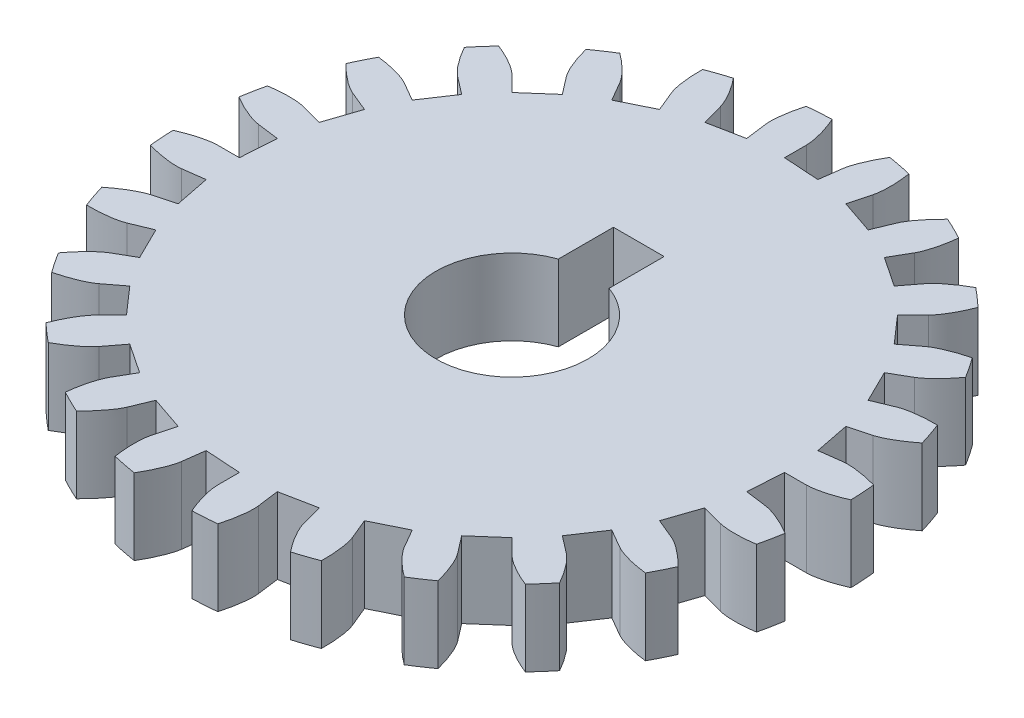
SolidWorks part; units mm, degrees
ref_plane "Front Plane" through (0, 0, 0) normal (0, 0, 1) x (1, 0, 0)
ref_plane "Top Plane" through (0, 0, 0) normal (0, 1, 0) x (1, 0, 0)
ref_plane "Right Plane" through (0, 0, 0) normal (1, 0, 0) x (0, 0, -1)
sketch "Sketch1" plane through (0, 0, 0) normal (0, 1, 0) x (1, 0, 0)
  line L0 (0, 0) -> (0, 5.8089) construction
  line L1 (0, 0) -> (-5.8089, 0) construction
  line L2 (0, 0) -> (-6.4861, -0.4251) construction
  line L3 (0, 0) -> (-5.7592, -0.7582) construction
  line L4 (0, 0) -> (-5.611, -1.5035) construction
  circle A0 centre (0, 0) radius 6 construction
  circle A1 centre (0, 0) radius 5.8089 construction
  circle A2 centre (0, 0) radius 5.375 construction
  circle A3 centre (0, 0) radius 6.5 construction
  spline S0 degree 4 poles (-5.8089, 0) (-5.8221, 0) (-5.8593, -0.0014) (-5.9292, -0.0093) (-6.0422, -0.0299) (-6.1841, -0.0671) (-6.3641, -0.1276) (-6.5708, -0.2146) (-6.7913, -0.3262) (-7.0229, -0.4642) (-7.2457, -0.6163) (-7.4597, -0.7807) (-7.6648, -0.9559) (-7.9031, -1.1803) (-8.1741, -1.4675) (-8.4679, -1.8248) (-8.7724, -2.2584) (-9.05, -2.7214) (-9.2956, -3.2019) (-9.5101, -3.6973) (-9.6942, -4.2043) (-9.8294, -4.6572) (-9.9272, -5.049) (-9.997, -5.3801) (-10.0457, -5.6429) (-10.0878, -5.9138) (-10.1228, -6.1734) (-10.1517, -6.4549) (-10.1728, -6.7004) (-10.1923, -7.0638) (-10.198, -7.2818) (-10.201, -7.6305) (-10.1944, -7.7985) (-10.1916, -7.9433) (-10.1888, -7.9825) (-10.1877, -8.0145) knots 0 0 0 0 0 0.005377 0.015084 0.028532 0.04661 0.064855 0.092111 0.119476 0.146842 0.174209 0.201575 0.228941 0.256307 0.307035 0.361767 0.4165 0.471232 0.525964 0.580697 0.635429 0.690161 0.717528 0.744894 0.77226 0.799626 0.826992 0.854358 0.881725 0.909091 0.954545 0.977273 0.988636 1 1 1 1 1 construction
  spline S1 degree 4 poles (-5.8089, 0) (-5.8221, 0) (-5.8593, -0.0014) (-5.9292, -0.0093) (-6.0422, -0.0299) (-6.1841, -0.0671) (-6.3641, -0.1276) (-6.5708, -0.2146) (-6.7913, -0.3262) (-7.0229, -0.4642) (-7.2457, -0.6163) (-7.4597, -0.7807) (-7.6648, -0.9559) (-7.9031, -1.1803) (-8.1741, -1.4675) (-8.4679, -1.8248) (-8.7724, -2.2584) (-9.05, -2.7214) (-9.2956, -3.2019) (-9.5101, -3.6973) (-9.6942, -4.2043) (-9.8294, -4.6572) (-9.9272, -5.049) (-9.997, -5.3801) (-10.0457, -5.6429) (-10.0878, -5.9138) (-10.1228, -6.1734) (-10.1517, -6.4549) (-10.1728, -6.7004) (-10.1854, -6.9343) (-10.1905, -7.0581) (-10.1926, -7.1193) knots 0 0 0 0 0 0.005377 0.015084 0.028532 0.04661 0.064855 0.092111 0.119476 0.146842 0.174209 0.201575 0.228941 0.256307 0.307035 0.361767 0.4165 0.471232 0.525964 0.580697 0.635429 0.690161 0.717528 0.744894 0.77226 0.799626 0.826992 0.854358 0.881725 0.909091 0.909091 0.909091 0.909091 0.909091
  dimension "D1" = 13
  dimension "D2" = 12
  dimension "D3" = 11.6178
  dimension "D4" = 10.75
  dimension "D5" = 5.8089
  dimension "D6" = 3.75
  dimension "D7" = 7.5
  dimension "D8" = 15
sketch "Sketch2" plane through (0, 0, 0) normal (0, 1, 0) x (1, 0, 0)
  line L0 (0, 0) -> (-6.4861, -0.4251) construction
  line L1 (0, 0) -> (-6.4861, -0.4251) construction
  line L2 (0, 0) -> (-5.7592, -0.7582) construction
  line L3 (0, 0) -> (-5.8089, 0) construction
  line L4 (0, 0) -> (-5.611, -1.5035) construction
  line L5 (0, 0) -> (-5.7592, -0.7582) construction
  line L6 (0, 0) -> (-5.8089, 0) construction
  line L7 (0, 0) -> (-5.611, -1.5035) construction
  line L8 (-5.7592, -0.7582) -> (-5.329, -0.7016)
  line L9 (-5.329, -0.7016) -> (-5.1919, -1.3912)
  line L10 (-5.1919, -1.3912) -> (-5.611, -1.5035) construction
  line L11 (-5.1919, -1.3912) -> (-1.4489, -0.3882)
  line L12 (-5.8089, 0) -> (-1.5, 0)
  circle A0 centre (0, 0) radius 5.375 construction
  circle A1 centre (0, 0) radius 5.8089 construction
  circle A2 centre (0, 0) radius 6 construction
  circle A3 centre (0, 0) radius 6.5 construction
  circle A4 centre (0, 0) radius 5.375 construction
  circle A5 centre (0, 0) radius 5.8089 construction
  circle A6 centre (0, 0) radius 6 construction
  circle A7 centre (0, 0) radius 6.5 construction
  arc A8 (-6.466, -0.6642) -> (-6.4974, -0.1854) centre (0, 0) cw
  circle A11 centre (0, 0) radius 1.5 construction
  arc A12 (-1.5, 0) -> (-1.4489, -0.3882) centre (0, 0) ccw
  spline S0 degree 4 poles (-35.4474, -999.5585) (-3.6528, -21.6436) (-4.0949, -0.4645) (-5.1086, 0.1399) (-6.0422, -0.0299) (-6.1841, -0.0671) (-6.3641, -0.1276) (-6.5708, -0.2146) (-6.7913, -0.3262) (-7.0229, -0.4642) (-7.2457, -0.6163) (-7.4597, -0.7807) (-7.6648, -0.9559) (-7.9031, -1.1803) (-8.1741, -1.4675) (-8.4679, -1.8248) (-8.7724, -2.2584) (-9.05, -2.7214) (-9.2956, -3.2019) (-9.5101, -3.6973) (-9.6942, -4.2043) (-9.8294, -4.6572) (-9.9272, -5.049) (-9.997, -5.3801) (-10.0457, -5.6429) (-10.0878, -5.9138) (-10.1228, -6.1734) (-10.1517, -6.4549) (-10.2561, -7.6695) (-10.2281, -10.7702) (-8.8427, 22.6639) (-42.7005, -1006.5684) knots -0.338379 -0.338379 -0.338379 -0.338379 -0.338379 0.005377 0.015084 0.028532 0.04661 0.064855 0.092111 0.119476 0.146842 0.174209 0.201575 0.228941 0.256307 0.307035 0.361767 0.4165 0.471232 0.525964 0.580697 0.635429 0.690161 0.717528 0.744894 0.77226 0.799626 0.826992 0.854358 0.881725 1.341059 1.341059 1.341059 1.341059 1.341059 only from (-5.8089, 0) to (-10.1926, -7.1193) construction
  spline S1 degree 4 poles (-5.8089, 0) (-5.8221, 0) (-5.8593, -0.0014) (-5.9292, -0.0093) (-6.0422, -0.0299) (-6.1841, -0.0671) (-6.3189, -0.1124) (-6.4203, -0.1524) (-6.4795, -0.1777) (-6.4974, -0.1854) knots 0 0 0 0 0 0.005377 0.015084 0.028532 0.04661 0.064855 0.072756 0.072756 0.072756 0.072756 0.072756
  spline S2 degree 4 poles (-5.7592, -0.7582) (-5.7723, -0.7599) (-5.8093, -0.7634) (-5.8797, -0.7647) (-5.9945, -0.7591) (-6.14, -0.7407) (-6.2795, -0.7133) (-6.3852, -0.6869) (-6.4473, -0.6696) (-6.466, -0.6642) knots 0 0 0 0 0 0.005377 0.015084 0.028532 0.04661 0.064855 0.072756 0.072756 0.072756 0.072756 0.072756
  point P21 (-5.329, -0.7016)
  point P24 (-5.1919, -1.3912)
  dimension "D2" = 3
extrude "Boss-Extrude1" add sketch "Sketch2" along normal blind 1.5
pattern_circular "CirPattern1" count 24 over 360 of "Boss-Extrude1"
sketch "Sketch3" plane through (0, 1.5, 0) normal (0, 1, 0) x (1, 0, 0)
  line L1 (0.5, 0.5) -> (-0.5, 0.5)
  line L2 (0.5, 0.5) -> (0.5, 2.5)
  line L3 (0.5, 2.5) -> (-0.5, 2.5)
  line L4 (-0.5, 0.5) -> (-0.5, 2.5)
  line L5 (0.5, 0.5) -> (-0.5, 2.5) construction
  line L6 (0.5, 2.5) -> (-0.5, 0.5) construction
  circle A0 centre (0, 0) radius 1.5 construction
  point P0 (0, 1.5)
  dimension "D1" = 2
  dimension "D2" = 1
extrude "Cut-Extrude1" cut sketch "Sketch3" against normal up to surface (1.5 mm away)
equation "\"Module\"= .5"
equation "\"Number of Teeth\" = 24"
equation "\"Pressure Angle\"= 14.5deg"
equation "\"Pitch Diameter\"= \"Number of Teeth\" * \"Module\""
equation "\"Circular Pitch\"= pi * \"Module\""
equation "\"Addendum\"= \"Module\""
equation "\"Dedendum\"= 1.25 * \"Module\""
equation "\"Base Diameter\"= \"Pitch Diameter\" * cos ( \"Pressure Angle\" )"
equation "\"Base Radius\"= \"Base Diameter\" / 2"
equation "\"Width\"= 1.5"
equation "\"Outside Diameter\"= \"Pitch Diameter\" + 2 * \"Addendum\""
equation "\"D1@Sketch1\"=\"Outside Diameter\""
equation "\"D3@Sketch1\"=\"Base Diameter\""
equation "\"Root Diameter\"= \"Pitch Diameter\" - 2 * \"Dedendum\""
equation "\"D4@Sketch1\"=\"Root Diameter\""
equation "\"Tooth Angle\"= 360 / \"Number of Teeth\""
equation "\"D6@Sketch1\"=\"Tooth Angle\"/4"
equation "\"D7@Sketch1\"=\"Tooth Angle\"/2"
equation "\"D8@Sketch1\"=\"Tooth Angle\""
equation "\"D2@Sketch1\" = \"Pitch Diameter\""
equation "\"Shaft Diameter\"= 3"
equation "\"D1@CirPattern1\" = \"Number of Teeth\""
equation "\"D2@Sketch2\"= \"Shaft Diameter\""
equation "\"D1@Boss-Extrude1\" = \"Width\""
